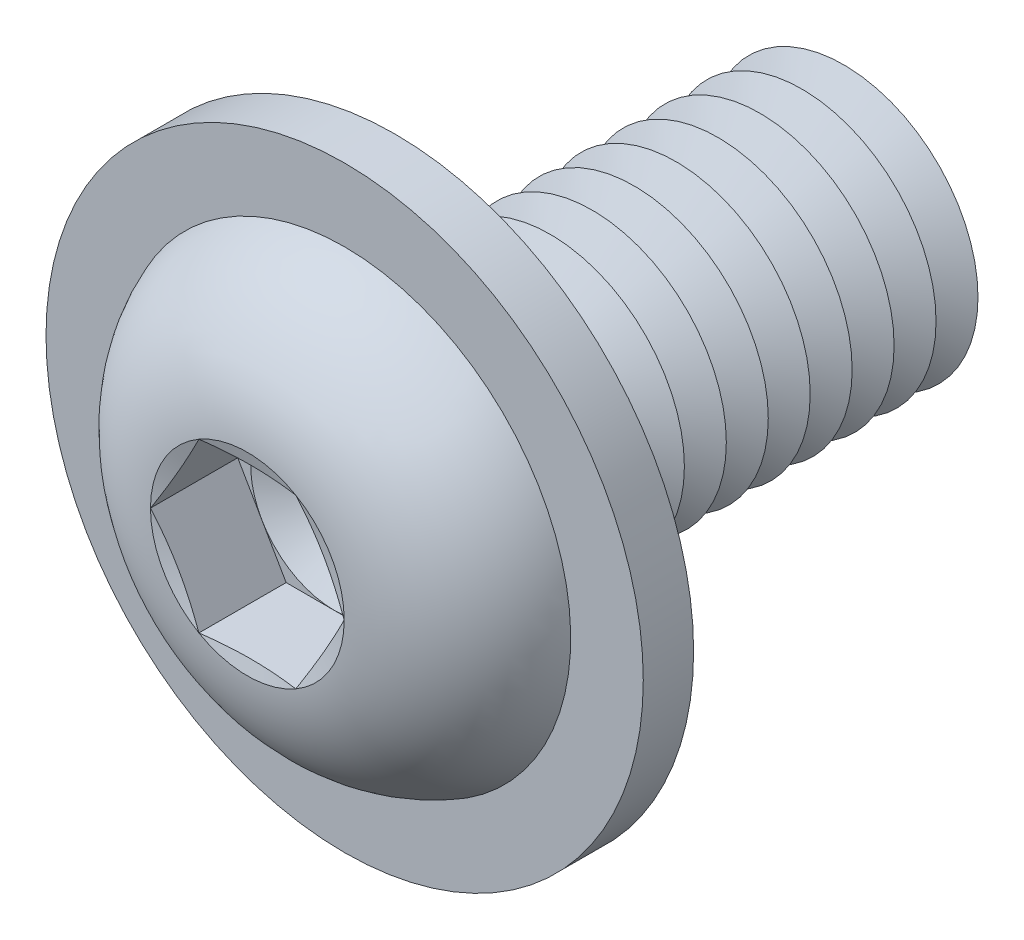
SolidWorks part; units mm, degrees
ref_plane "Front Plane" through (0, 0, 0) normal (0, 0, 1) x (1, 0, 0)
ref_plane "Top Plane" through (0, 0, 0) normal (0, 1, 0) x (1, 0, 0)
ref_plane "Right Plane" through (0, 0, 0) normal (1, 0, 0) x (0, 0, -1)
sketch "Sketch1" plane through (0, 0, 0) normal (1, 0, 0) x (0, 0, -1)
  line L0 (0, 4) -> (0, 7)
  line L3 (0, 4) -> (14, 4)
  line L4 (14, 4) -> (14, 0)
  line L5 (14, 0) -> (-4.4, 0) construction
  line L6 (-4.4, 0) -> (14, 0)
  line L7 (-4.4, 2.8867) -> (-4.4, 1.4434) construction
  line L8 (-4.4, 1.4434) -> (-4.4, 0)
  line L9 (-4.4, 2.8867) -> (-4.0132, 1.4434)
  line L10 (-4.0132, 1.4434) -> (-4.4, 1.4434)
  line L11 (14, 0) -> (22.7481, 0) construction
  line L12 (0, 7) -> (-4.4, 7) construction
  arc A1 (0, 7) -> (-4.4, 2.8867) centre (0, 2.59) ccw
  point P8 (14, 2)
  dimension "D1" = 14
  dimension "D2" = 8
  dimension "D3" = 4.4
  dimension "D4" = 5.7735
  dimension "D5" = 14
  dimension "D6" = 15
revolve "Revolve1" add sketch "Sketch1" angle 360 about L5
fillet "Fillet1" radius 0.625 1 edges at (-4, 0, 0)
sketch "Sketch2" plane through (0, 0, 0) normal (1, 0, 0) x (0, 0, -1)
  line L0 (13.375, 4) -> (14.625, 4)
  line L1 (14, 4) -> (0.625, 4) construction
  line L2 (14.625, 4) -> (14, 2.9175)
  line L3 (14, -4) -> (14, 4) construction
  line L4 (14, 2.9175) -> (13.375, 4)
  dimension "D1" = 1.25
revolve "Cut-Revolve1" cut sketch "Sketch2" angle 360 about axis through (0, 0, -14) along (0, 0, -1)
pattern_linear "LPattern1" count 11 spacing 1.25 along (0, 0, 1) of "Cut-Revolve1"
sketch "Sketch3" plane through (0, 0, 4.4) normal (0, 0, 1) x (1, 0, 0)
  line L7 (1.4434, 2.5) -> (-1.4434, 2.5)
  line L8 (-1.4434, 2.5) -> (-2.8867, 0)
  line L9 (-2.8867, 0) -> (-1.4434, -2.5)
  line L10 (-1.4434, -2.5) -> (1.4434, -2.5)
  line L11 (1.4434, -2.5) -> (2.8867, 0)
  line L12 (2.8867, 0) -> (1.4434, 2.5)
  circle A0 centre (0, 0) radius 2.5 construction
  circle A3 centre (0, 0) radius 2.8867 construction
extrude "Cut-Extrude1" cut sketch "Sketch3" against normal blind 2.6
sketch "Sketch4" plane through (0, 0, 1.8) normal (0, 0, 1) x (1, 0, 0)
  line L1 (1.4434, 2.5) -> (-1.4434, 2.5) construction
  circle A0 centre (0, 0) radius 2.5
extrude "Cut-Extrude2" cut sketch "Sketch4" against normal through all draft 60
sketch "Sketch5" plane through (0, 0, 0) normal (0, 0, -1) x (-1, 0, 0)
  circle A0 centre (0, 0) radius 8.9
  circle A1 centre (0, 0) radius 4.625
  circle A2 centre (0, 0) radius 4.625 construction
  dimension "D1" = 17.8
extrude "Boss-Extrude1" add sketch "Sketch5" against normal blind 1.5
